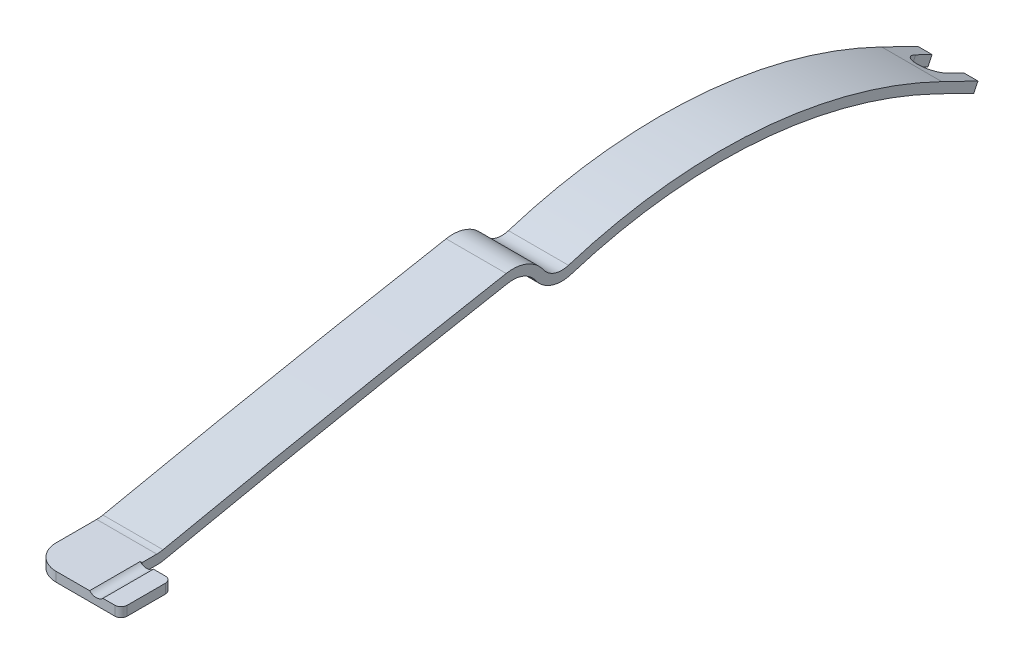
SolidWorks part; units mm, degrees
ref_plane "Спереди" through (0, 0, 0) normal (0, 0, 1) x (1, 0, 0)
ref_plane "Сверху" through (0, 0, 0) normal (0, 1, 0) x (1, 0, 0)
ref_plane "Справа" through (0, 0, 0) normal (1, 0, 0) x (0, 0, -1)
sketch "Эскиз1" plane through (0, 0, 0) normal (1, 0, 0) x (0, 0, -1)
  line L0 (-53.34, 0) -> (-44.9845, 0)
  line L1 (55.0497, 2.2554) -> (59.69, 0)
  line L2 (-53.34, 0) -> (-53.34, 1.2141)
  line L3 (-53.34, 1.2141) -> (-44.9845, 1.2141)
  line L4 (59.69, 0) -> (60.2207, 1.092)
  line L5 (60.2207, 1.092) -> (55.5805, 3.3474)
  arc A0 (-43.9281, 0.1111) -> (0, 8.7692) centre (268.6454, -1470.0067) cw
  arc A1 (0, 8.7692) -> (3.5626, 7.2898) centre (0.6356, 5.2704) cw
  arc A2 (3.5626, 7.2898) -> (8.128, 5.7212) centre (6.9077, 9.5976) ccw
  arc A3 (8.128, 5.7212) -> (55.0497, 2.2554) centre (27.2338, -54.9733) cw
  arc A4 (-44.9845, 0) -> (-43.9281, 0.1111) centre (-44.9845, 5.08) ccw
  arc A5 (-44.9845, 1.2141) -> (-44.1806, 1.2986) centre (-44.9845, 5.08) ccw
  arc A6 (-0.217, 9.9637) -> (-44.1806, 1.2986) centre (268.6454, -1470.0067) ccw
  arc A7 (4.562, 7.9793) -> (7.7634, 6.8793) centre (6.9077, 9.5976) ccw
  arc A8 (-0.217, 9.9637) -> (4.562, 7.9793) centre (0.6356, 5.2704) cw
  arc A9 (7.7634, 6.8793) -> (55.5805, 3.3474) centre (27.2338, -54.9733) cw
  point P14 (-44.45, 0)
  dimension "D3" = 4.064
  dimension "D4" = 3.556
  dimension "D6" = 7.2898
  dimension "D7" = 5.08
  dimension "D10" = 3.048
  dimension "D11" = 1.2141
  dimension "D1" = 53.34
  dimension "D2" = 113.03
  dimension "D5" = 8.128
  dimension "D8" = 8.89
  dimension "D9" = 5.1594
extrude "Бобышка-Вытянуть1" add sketch "Эскиз1" along normal blind 7.6962
sketch "Эскиз2" plane through (0, 24.56, -11.9374) normal (0, 0.8994, -0.4371) x (1, 0, 0)
  line L0 (3.8481, 53.6846) -> (3.8481, 49.319) construction
  line L1 (1.8161, 51.351) -> (1.8161, 53.6846)
  line L2 (7.6962, 53.6846) -> (0, 53.6846) construction
  line L3 (1.8161, 53.6846) -> (5.8801, 53.6846)
  line L4 (5.8801, 53.6846) -> (5.8801, 51.351)
  arc A0 (5.8801, 51.351) -> (1.8161, 51.351) centre (3.8481, 51.351) cw
  dimension "D1" = 4.064
  dimension "D2" = 4.3656
extrude "Вырез-Вытянуть1" cut sketch "Эскиз2" against normal through all
sketch "Эскиз3" plane through (0, 1.2141, 0) normal (0, 1, 0) x (1, 0, 0)
  line L0 (0, -44.9845) -> (0, -53.34) construction
  line L1 (7.6962, -53.34) -> (10.687, -53.34)
  line L2 (7.6962, -53.34) -> (7.6962, -46.863)
  line L3 (7.6962, -46.863) -> (10.687, -46.863)
  line L4 (11.4808, -52.5462) -> (11.4808, -47.6568)
  arc A0 (10.687, -46.863) -> (11.4808, -47.6568) centre (10.687, -47.6568) cw
  arc A1 (10.687, -53.34) -> (11.4808, -52.5462) centre (10.687, -52.5462) ccw
  point P5 (0, -49.1623)
  dimension "D3" = 0.7937
  dimension "D1" = 11.4808
  dimension "D2" = 6.477
extrude "Бобышка-Вытянуть2" add sketch "Эскиз3" against normal up to surface (1.2141 mm away)
fillet "Скругление1" radius 3.175 1 edges at (0, 0.6071, 53.34)
sketch "Эскиз4" plane through (0, 0, 46.863) normal (0, 0, -1) x (-1, 0, 0)
  line L0 (-11.4808, 0) -> (-11.4808, 1.2141) construction
  line L1 (-10.687, 1.2141) -> (-7.6962, 1.2141) construction
  circle A0 centre (-8.3058, 2.0491) radius 1.1906
  point P4 (-8.3058, 0.8585)
  dimension "D2" = 2.3813
  dimension "D1" = 3.175
  dimension "D3" = 0.3556
extrude "Вырез-Вытянуть2" cut sketch "Эскиз4" against normal up to surface (6.477 mm away)
